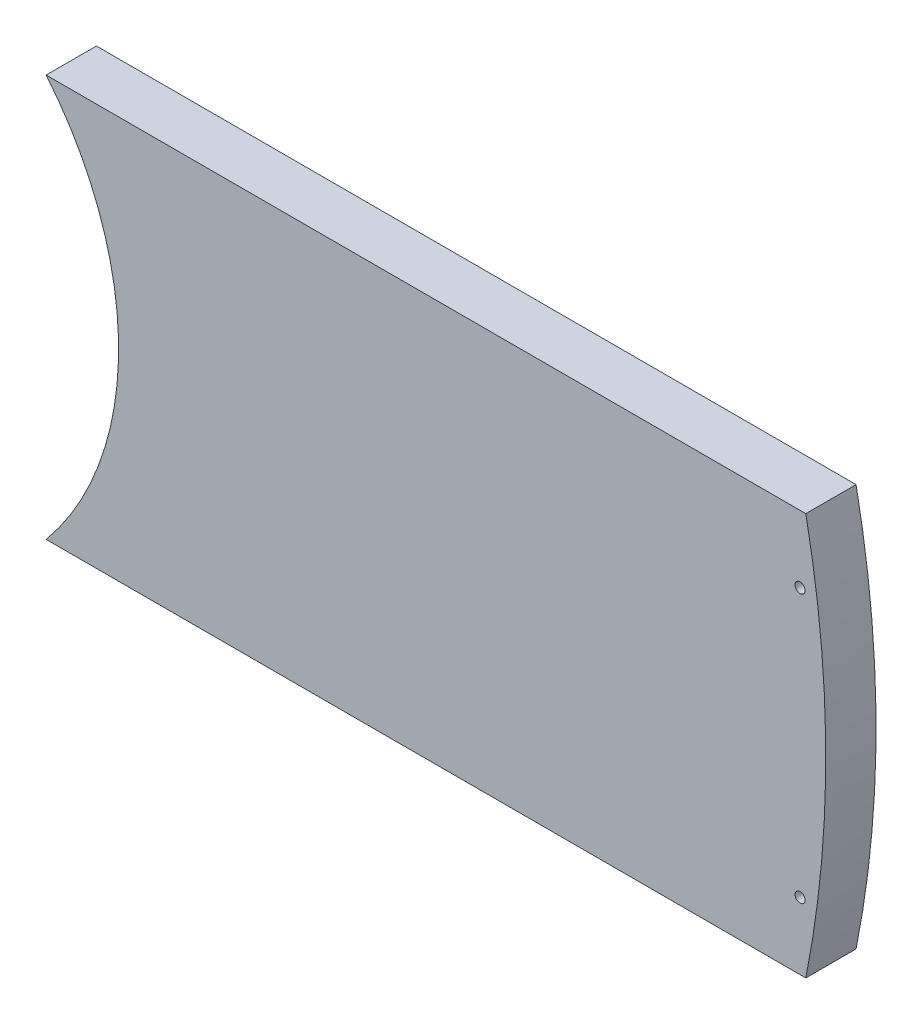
SolidWorks part; units mm, degrees
ref_plane "Plan de face" through (0, 0, 0) normal (0, 0, 1) x (1, 0, 0)
ref_plane "Plan de dessus" through (0, 0, 0) normal (0, 1, 0) x (1, 0, 0)
ref_plane "Plan de droite" through (0, 0, 0) normal (1, 0, 0) x (0, 0, -1)
sketch "Esquisse1" plane through (0, 0, 0) normal (0, 0, 1) x (1, 0, 0)
  line L0 (0, 0) -> (412.4936, 0) construction
  line L1 (72.3602, -60) -> (299.0401, -60)
  line L2 (72.3602, 60) -> (299.0401, 60)
  line L4 (0, 60) -> (412.4936, 60) construction
  line L5 (0, -60) -> (412.4936, -60) construction
  arc A1 (72.3602, -60) -> (72.3602, 60) centre (0, 0) ccw
  circle A2 centre (297.3214, 40) radius 1.5
  circle A3 centre (297.3214, -40) radius 1.5
  arc A5 (297.5177, -38.5129) -> (297.5177, 38.5129) centre (0, 0) ccw construction
  arc A6 (299.0401, -60) -> (299.0401, 60) centre (0, 0) ccw
  dimension "D1" = 188
  dimension "D2" = 300
  dimension "D5" = 3
  dimension "D7" = 610
  dimension "D6" = 80
  dimension "D3" = 60
  dimension "D4" = 60
extrude "Boss.-Extru.1" add sketch "Esquisse1" along normal blind 15
sketch "Esquisse2" plane through (0, 0, 0) normal (0, 0, -1) x (-1, 0, 0)
  line L0 (0, 0) -> (-115.9666, 0) construction
  line L1 (-118, 12) -> (-68.5497, 12)
  line L2 (-118, 12) -> (-118, -12)
  line L3 (-118, -12) -> (-68.5497, -12)
  line L4 (-68.5497, 12) -> (-68.5497, -12)
  arc A0 (-72.3602, 60) -> (-72.3602, -60) centre (0, 0) ccw construction
  point P7 (-94, 0)
  dimension "D1" = 24
  dimension "D2" = 24
extrude "Enlèv. mat.-Extru.1" cut sketch "Esquisse2" against normal blind 12
shell "Coque1" thickness 3
